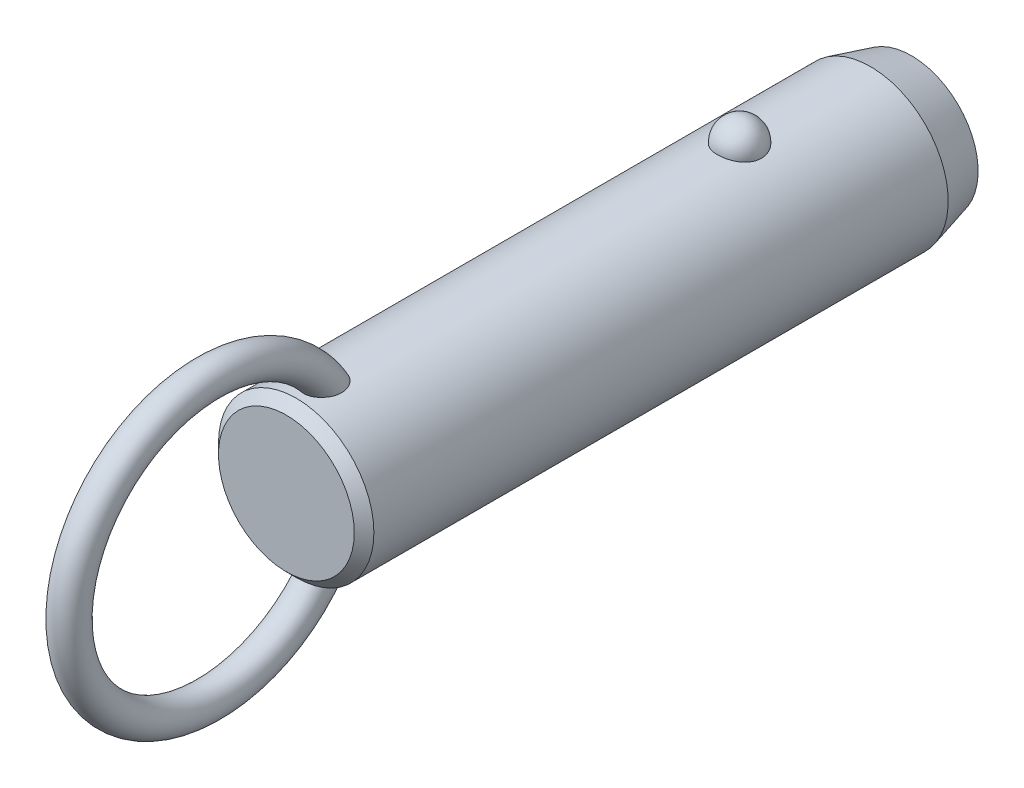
SolidWorks part; units mm, degrees
ref_plane "Front Plane" through (0, 0, 0) normal (0, 0, 1) x (1, 0, 0)
ref_plane "Top Plane" through (0, 0, 0) normal (0, 1, 0) x (1, 0, 0)
ref_plane "Right Plane" through (0, 0, 0) normal (1, 0, 0) x (0, 0, -1)
sketch "Sketch2" plane through (0, 0, 0) normal (0, 0, 1) x (1, 0, 0)
  circle A0 centre (0, 0) radius 9.5
  point P3 (0, 9.5)
  dimension "D1" = 19
extrude "Boss-Extrude1" add sketch "Sketch2" along normal blind 43.2
sketch "Sketch3" plane through (0, 0, 0) normal (0, 0, -1) x (-1, 0, 0)
  circle A0 centre (0, 0) radius 9.5
  dimension "D1" = 19
extrude "Boss-Extrude2" add sketch "Sketch3" along normal blind 23.7
chamfer "Chamfer1" distance 5 angle 15 1 edges at (-9.5, 0, -23.7)
sketch "Sketch12" plane through (0, 0, 0) normal (1, 0, 0) x (0, 0, -1)
  line L0 (-43.2, 9.5) -> (-43.2, -9.5) construction
  point P0 (-43.2, 0)
sketch "Sketch13" plane through (0, 0, 0) normal (1, 0, 0) x (0, 0, -1)
  circle A0 centre (-62.25, 0) radius 19.05
  point P2 (-43.2, 0)
  dimension "D1" = 38.1
sketch "Sketch14" plane through (0, 0, 0) normal (0, 1, 0) x (1, 0, 0)
  circle A0 centre (0, -45.2) radius 2
  point P2 (0, -43.2)
  dimension "D1" = 4
sweep "Sweep1" add profiles "Sketch14" path "Sketch13"
sketch "Sketch15" plane through (0, 0, 43.2) normal (0, 0, 1) x (1, 0, 0)
  circle A0 centre (0, 0) radius 9.5
  dimension "D1" = 19
extrude "Boss-Extrude3" add sketch "Sketch15" along normal blind 9.52
chamfer "Chamfer2" distance 1.2 angle 45 1 edges at (9.5, 0, 52.72)
sketch "Sketch18" plane through (0, 0, 0) normal (1, 0, 0) x (0, 0, -1)
  line L0 (18.7, 9.5) -> (-45.7378, 9.5) construction
  line L1 (2.7, 12.2) -> (2.7, 6.8)
  line L2 (-45.7378, -9.5) -> (18.7, -9.5) construction
  arc A0 (2.7, 12.2) -> (2.7, 6.8) centre (2.7, 9.5) ccw
  point P4 (0, 9.5)
  dimension "D1" = 21.7
revolve "Revolve1" add sketch "Sketch18" angle 360 about L1
